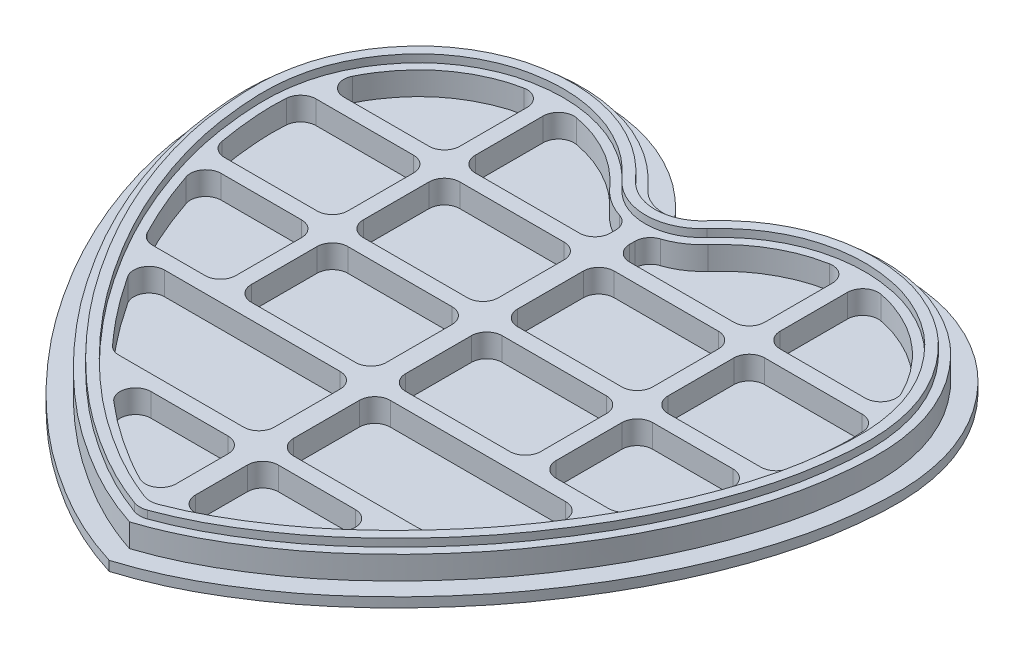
SolidWorks part; units mm, degrees
ref_plane "Front Plane" through (0, 0, 0) normal (0, 0, 1) x (1, 0, 0)
ref_plane "Top Plane" through (0, 0, 0) normal (0, 1, 0) x (1, 0, 0)
ref_plane "Right Plane" through (0, 0, 0) normal (1, 0, 0) x (0, 0, -1)
sketch "Sketch1" plane through (0, 0, 0) normal (0, 1, 0) x (1, 0, 0)
  arc A0 (-4.7475, 190.8725) -> (4.7475, 190.8725) centre (0, 195.0896) ccw
  spline S0 degree 3 poles (0, 0) (-6.9704, 2.1411) (-17.3052, 6.5092) (-30.2851, 14.3663) (-40.1508, 21.1835) (-49.6034, 29.0743) (-58.743, 37.7359) (-67.3785, 47.1382) (-75.5752, 57.1133) (-82.955, 67.7484) (-89.7919, 78.7217) (-95.738, 90.1158) (-100.8249, 101.7554) (-104.934, 113.6029) (-108.0334, 125.5149) (-109.7563, 137.4697) (-110.4471, 147.5565) (-110.0632, 155.7161) (-109.1075, 161.8984) (-107.688, 167.8632) (-105.6136, 173.5598) (-103.0387, 178.9712) (-99.994, 184.084) (-96.4904, 188.8114) (-92.6277, 193.2321) (-88.3533, 197.2568) (-83.6456, 200.8156) (-78.6368, 203.9332) (-73.2922, 206.5079) (-67.7257, 208.658) (-61.8582, 210.0699) (-55.8523, 211.0164) (-49.2375, 211.3688) (-42.1783, 210.9497) (-34.8451, 209.5327) (-27.8211, 207.308) (-21.2163, 204.1683) (-15.0288, 200.3457) (-9.5539, 195.8446) (-6.2412, 192.5542) (-4.7475, 190.8725) knots 0 0 0 0 0.062261 0.09531 0.129472 0.164592 0.200365 0.236953 0.273568 0.310548 0.347436 0.383933 0.420222 0.455837 0.490947 0.525167 0.558872 0.577133 0.594814 0.612233 0.62942 0.646491 0.663354 0.680162 0.696681 0.71344 0.73021 0.74701 0.763743 0.780818 0.797872 0.815181 0.832691 0.854352 0.875406 0.896334 0.917108 0.937714 0.958297 0.977512 0.977512 0.977512 0.977512
  spline S1 degree 3 poles (0, 0) (6.9704, 2.1411) (17.3052, 6.5092) (30.2851, 14.3663) (40.1508, 21.1835) (49.6034, 29.0743) (58.743, 37.7359) (67.3785, 47.1382) (75.5752, 57.1133) (82.955, 67.7484) (89.7919, 78.7217) (95.738, 90.1158) (100.8249, 101.7554) (104.934, 113.6029) (108.0334, 125.5149) (109.7563, 137.4697) (110.4471, 147.5565) (110.0632, 155.7161) (109.1075, 161.8984) (107.688, 167.8632) (105.6136, 173.5598) (103.0387, 178.9712) (99.994, 184.084) (96.4904, 188.8114) (92.6277, 193.2321) (88.3533, 197.2568) (83.6456, 200.8156) (78.6368, 203.9332) (73.2922, 206.5079) (67.7257, 208.658) (61.8582, 210.0699) (55.8523, 211.0164) (49.2375, 211.3688) (42.1783, 210.9497) (34.8451, 209.5327) (27.8211, 207.308) (21.2163, 204.1683) (15.0288, 200.3457) (9.5539, 195.8446) (6.2412, 192.5542) (4.7475, 190.8725) knots 0 0 0 0 0.062261 0.09531 0.129472 0.164592 0.200365 0.236953 0.273568 0.310548 0.347436 0.383933 0.420222 0.455837 0.490947 0.525167 0.558872 0.577133 0.594814 0.612233 0.62942 0.646491 0.663354 0.680162 0.696681 0.71344 0.73021 0.74701 0.763743 0.780818 0.797872 0.815181 0.832691 0.854352 0.875406 0.896334 0.917108 0.937714 0.958297 0.977512 0.977512 0.977512 0.977512
  dimension "D1" = 6.35
extrude "Boss-Extrude1" add sketch "Sketch1" along normal blind 3.175
sketch "Sketch4" plane through (0, 3.175, 0) normal (0, 1, 0) x (1, 0, 0)
  arc A1 (-9.495, 186.6555) -> (9.495, 186.6555) centre (0, 195.0896) ccw
  arc A2 (-9.495, 186.6555) -> (9.495, 186.6555) centre (0, 195.0896) ccw
  spline S4 degree 3 number of poles 122 (-9.495, 186.6555) -> (0, 6.6626)
  spline S5 degree 3 number of poles 124 (0, 6.6626) -> (9.495, 186.6555)
  spline S6 degree 3 number of poles 122 (-9.495, 186.6555) -> (0, 6.6626)
  spline S7 degree 3 number of poles 124 (0, 6.6626) -> (9.495, 186.6555)
  dimension "D1" = 6.35
extrude "Boss-Extrude3" add sketch "Sketch4" along normal blind 7.62
sketch "Sketch5" plane through (0, 10.795, 0) normal (0, 1, 0) x (1, 0, 0)
  line L1 (-3.175, 162.9059) -> (-3.175, 173.7344)
  line L2 (3.175, 162.9059) -> (3.175, 173.7344)
  line L3 (-93.1372, 162.9059) -> (-52.6696, 162.9059)
  line L4 (52.6696, 162.9059) -> (93.137, 162.9059)
  line L5 (-94.2805, 157.8259) -> (-52.6696, 157.8259)
  line L6 (3.175, 162.9059) -> (47.5896, 162.9059)
  line L7 (-92.3343, 126.0759) -> (-52.6696, 126.0759)
  line L8 (-47.5896, 162.9059) -> (-3.175, 162.9059)
  line L9 (-141.8606, 126.0759) -> (144.7018, 126.0759)
  line L10 (-141.8606, 157.8259) -> (144.7018, 157.8259)
  line L13 (-141.8606, 89.2459) -> (144.7018, 89.2459)
  line L14 (-141.8606, 120.9959) -> (144.7018, 120.9959)
  line L17 (-141.8606, 52.4159) -> (144.7018, 52.4159)
  line L18 (-141.8606, 84.1659) -> (144.7018, 84.1659)
  line L21 (-141.8606, 15.5859) -> (144.7018, 15.5859)
  line L22 (-141.8606, 47.3359) -> (144.7018, 47.3359)
  line L24 (-3.175, 17.2878) -> (-3.175, 47.3359)
  line L25 (-78.0235, 89.2459) -> (-52.6696, 89.2459)
  line L26 (-91.0427, 120.9959) -> (-52.6696, 120.9959)
  line L27 (3.175, 157.8259) -> (47.5896, 157.8259)
  line L28 (3.175, 17.2878) -> (3.175, 47.3359)
  line L29 (-51.4861, 52.4159) -> (-3.175, 52.4159)
  line L30 (-75.137, 84.1659) -> (-3.175, 84.1659)
  line L31 (-52.6696, 236.659) -> (-47.5896, 236.659)
  line L32 (3.175, 84.1659) -> (75.137, 84.1659)
  line L33 (3.175, 126.0759) -> (3.175, 157.8259)
  line L34 (-46.5896, 47.3359) -> (-3.175, 47.3359)
  line L35 (-3.175, 89.2459) -> (-3.175, 120.9959)
  line L37 (-8.843, 15.5859) -> (8.8433, 15.5859)
  line L38 (-52.6696, 195.8923) -> (-52.6696, 162.9059)
  line L39 (-3.175, 126.0759) -> (-3.175, 157.8259)
  line L40 (3.175, 126.0759) -> (47.5896, 126.0759)
  line L41 (3.175, 120.9959) -> (47.5896, 120.9959)
  line L42 (3.175, 89.2459) -> (47.5896, 89.2459)
  line L43 (3.175, 89.2459) -> (3.175, 120.9959)
  line L44 (3.175, 52.4159) -> (51.4862, 52.4159)
  line L45 (3.175, 47.3359) -> (46.5896, 47.3359)
  line L46 (-3.175, 52.4159) -> (-3.175, 84.1659)
  line L47 (3.175, 52.4159) -> (3.175, 84.1659)
  line L48 (52.6696, 157.8259) -> (94.2806, 157.8259)
  line L49 (-47.5896, 195.9577) -> (-47.5896, 162.9059)
  line L50 (-47.5896, 126.0759) -> (-3.175, 126.0759)
  line L52 (-52.6696, 120.9959) -> (-52.6696, 89.2459)
  line L53 (-47.5896, 120.9959) -> (-47.5896, 89.2459)
  line L54 (52.6696, 126.0759) -> (92.3343, 126.0759)
  line L55 (-47.5896, 157.8259) -> (-3.175, 157.8259)
  line L56 (-47.5896, 157.8259) -> (-47.5896, 126.0759)
  line L57 (-52.6696, 157.8259) -> (-52.6696, 126.0759)
  line L58 (-47.5896, 120.9959) -> (-3.175, 120.9959)
  line L59 (-47.5896, 89.2459) -> (-3.175, 89.2459)
  line L60 (47.5896, 195.9577) -> (47.5896, 126.0759)
  line L62 (52.6696, 195.8924) -> (52.6696, 126.0759)
  line L63 (52.6696, 120.9959) -> (91.0427, 120.9959)
  line L66 (47.5896, 120.9959) -> (47.5896, 89.2459)
  line L67 (52.6696, 120.9959) -> (52.6696, 89.2459)
  line L68 (52.6696, 89.2459) -> (78.0235, 89.2459)
  arc A1 (3.175, 173.7344) -> (16.1414, 180.7515) centre (0, 195.0896) ccw
  arc A6 (-16.1414, 180.7515) -> (16.1414, 180.7515) centre (0, 195.0896) ccw
  arc A7 (-16.1414, 180.7515) -> (-3.175, 173.7344) centre (0, 195.0896) ccw
  spline S0 degree 3 poles (47.5896, 195.9577) (47.4876, 195.9532) (47.3856, 195.9484) (46.5397, 195.9059) (45.7926, 195.8493) (44.3115, 195.6978) (43.5761, 195.6024) (41.3849, 195.2613) (39.9436, 194.961) (37.0959, 194.2297) (35.6892, 193.7996) (33.611, 193.0359) (32.9238, 192.7608) (31.5601, 192.1702) (30.8819, 191.8543) (28.8739, 190.8589) (27.5742, 190.1394) (25.6855, 188.973) (25.0664, 188.5692) (23.8519, 187.7276) (23.2569, 187.2892) (21.5048, 185.9269) (20.3789, 184.9583) (18.1913, 182.929) (17.1344, 181.8693) (16.1414, 180.7515) knots 0.873928 0.873928 0.873928 0.873928 0.875 0.875 0.882812 0.882812 0.890625 0.890625 0.90625 0.90625 0.921875 0.921875 0.929687 0.929687 0.9375 0.9375 0.953125 0.953125 0.960937 0.960937 0.96875 0.96875 0.984375 0.984375 1 1 1 1
  spline S1 degree 3 poles (93.137, 162.9059) (93.0147, 163.3366) (92.8856, 163.7639) (92.5235, 164.8889) (92.2788, 165.5808) (91.4957, 167.6324) (90.9106, 168.9692) (89.625, 171.5861) (88.9248, 172.8663) (87.3985, 175.3649) (86.5683, 176.5813) (85.2315, 178.3609) (84.7735, 178.9447) (83.8387, 180.0894) (83.3609, 180.6508) (81.8939, 182.3001) (80.8705, 183.3521) (78.7152, 185.3425) (77.581, 186.2786) (75.2083, 188.0416) (73.9688, 188.8772) (72.0724, 190.0241) (71.4324, 190.3887) (70.136, 191.0801) (69.4798, 191.4079) (68.1545, 192.0339) (67.4855, 192.3325) (66.1364, 192.9045) (65.4559, 193.1771) (64.0783, 193.6844) (63.3808, 193.9181) (61.9637, 194.3357) (61.2448, 194.5212) (59.7924, 194.8586) (59.0626, 195.0102) (57.6029, 195.2858) (56.8719, 195.4095) (54.9864, 195.6854) (53.8298, 195.8117) (52.6696, 195.8924) knots 0.659341 0.659341 0.659341 0.659341 0.664062 0.664062 0.671875 0.671875 0.6875 0.6875 0.703125 0.703125 0.71875 0.71875 0.726562 0.726562 0.734375 0.734375 0.75 0.75 0.765625 0.765625 0.78125 0.78125 0.789062 0.789062 0.796875 0.796875 0.804687 0.804687 0.8125 0.8125 0.820312 0.820312 0.828125 0.828125 0.835937 0.835937 0.84375 0.84375 0.856053 0.856053 0.856053 0.856053
  spline S3 degree 3 poles (51.4862, 52.4159) (53.037, 54.0896) (54.558, 55.792) (57.9625, 59.7266) (59.8302, 61.9741) (62.5419, 65.4315) (63.4303, 66.5987) (65.1754, 68.9638) (66.0325, 70.1611) (67.721, 72.5803) (68.5519, 73.8016) (70.1859, 76.2535) (70.9904, 77.4853) (72.9319, 80.5225) (74.0526, 82.3356) (75.137, 84.1659) knots 0.225541 0.225541 0.225541 0.225541 0.25 0.25 0.28125 0.28125 0.296875 0.296875 0.3125 0.3125 0.328125 0.328125 0.34375 0.34375 0.366455 0.366455 0.366455 0.366455
  spline S4 degree 3 poles (-75.137, 84.1659) (-74.0404, 82.3151) (-72.9069, 80.4821) (-70.9511, 77.4248) (-70.1456, 76.1924) (-68.5099, 73.7394) (-67.6786, 72.5185) (-65.1479, 68.8962) (-63.4066, 66.5321) (-59.7922, 61.9275) (-57.9247, 59.6816) (-54.5325, 55.7636) (-53.0242, 54.0758) (-51.4861, 52.4159) knots 0.633313 0.633313 0.633313 0.633313 0.65625 0.65625 0.671875 0.671875 0.6875 0.6875 0.71875 0.71875 0.75 0.75 0.774254 0.774254 0.774254 0.774254
  spline S5 degree 3 poles (-46.5896, 47.3359) (-45.7271, 46.4767) (-44.8553, 45.6263) (-41.8618, 42.7686) (-39.6973, 40.8013) (-35.2601, 36.9682) (-32.9822, 35.1054) (-28.271, 31.5334) (-25.8603, 29.845) (-22.1874, 27.4132) (-20.9542, 26.6183) (-18.4681, 25.0637) (-17.2146, 24.3048) (-14.6812, 22.8339) (-13.4011, 22.1222) (-10.8085, 20.7561) (-9.4965, 20.101) (-6.5289, 18.7013) (-4.8648, 17.9717) (-3.175, 17.2878) knots 0.79946 0.79946 0.79946 0.79946 0.8125 0.8125 0.84375 0.84375 0.875 0.875 0.90625 0.90625 0.921875 0.921875 0.9375 0.9375 0.953125 0.953125 0.96875 0.96875 0.988036 0.988036 0.988036 0.988036
  spline S6 degree 3 poles (78.0235, 89.2459) (78.8709, 90.8037) (79.6912, 92.3744) (81.7938, 96.5641) (83.0343, 99.203) (86.5406, 107.2219) (88.5802, 112.7093) (90.542, 119.2338) (90.797, 120.1127) (91.0427, 120.9959) knots 0.387272 0.387272 0.387272 0.387272 0.40625 0.40625 0.4375 0.4375 0.5 0.5 0.50968 0.50968 0.50968 0.50968
  spline S7 degree 3 poles (-91.0427, 120.9959) (-90.7976, 120.1152) (-90.5427, 119.2363) (-88.5765, 112.6964) (-86.5312, 107.1972) (-83.0167, 99.1644) (-81.7735, 96.5216) (-79.6752, 92.3438) (-78.8626, 90.7885) (-78.0235, 89.2459) knots 0.490345 0.490345 0.490345 0.490345 0.5 0.5 0.5625 0.5625 0.59375 0.59375 0.612518 0.612518 0.612518 0.612518
  spline S8 degree 3 poles (92.3343, 126.0759) (92.4008, 126.3663) (92.466, 126.657) (93.1646, 129.8372) (93.6589, 132.7486) (94.2407, 137.1407) (94.4096, 138.6086) (94.7006, 141.5518) (94.8216, 143.0281) (94.991, 145.9887) (95.0388, 147.4658) (95.0349, 150.4117) (94.9831, 151.8805) (94.7439, 154.8065) (94.5519, 156.2634) (94.2935, 157.752) (94.287, 157.789) (94.2806, 157.8259) knots 0.528104 0.528104 0.528104 0.528104 0.53125 0.53125 0.5625 0.5625 0.578125 0.578125 0.59375 0.59375 0.609375 0.609375 0.625 0.625 0.640625 0.640625 0.641022 0.641022 0.641022 0.641022
  spline S10 degree 3 poles (-52.6696, 195.8923) (-53.8064, 195.8133) (-54.9414, 195.6903) (-56.8083, 195.4198) (-57.5414, 195.2966) (-59.0063, 195.0216) (-59.7378, 194.8703) (-61.1847, 194.5362) (-61.9015, 194.3524) (-63.3165, 193.9386) (-64.014, 193.7066) (-65.3926, 193.2017) (-66.0742, 192.9299) (-67.4262, 192.3585) (-68.097, 192.06) (-69.427, 191.4337) (-70.086, 191.1057) (-71.3894, 190.4127) (-72.0333, 190.0469) (-73.3065, 189.2786) (-73.9361, 188.8767) (-75.1684, 188.0488) (-75.7728, 187.6215) (-77.5521, 186.3014) (-78.6889, 185.3654) (-80.8533, 183.3694) (-81.8833, 182.3123) (-83.361, 180.6504) (-83.8431, 180.0832) (-84.7851, 178.9297) (-85.2435, 178.3455) (-86.5772, 176.5683) (-87.4089, 175.3495) (-88.9428, 172.8352) (-89.649, 171.5421) (-90.623, 169.5519) (-90.9332, 168.8799) (-91.5239, 167.5184) (-91.8054, 166.8271) (-92.3314, 165.4354) (-92.5756, 164.7358) (-92.9177, 163.6578) (-93.0302, 163.2824) (-93.1372, 162.9059) knots 0.144186 0.144186 0.144186 0.144186 0.15625 0.15625 0.164062 0.164062 0.171875 0.171875 0.179687 0.179687 0.1875 0.1875 0.195312 0.195312 0.203125 0.203125 0.210937 0.210937 0.21875 0.21875 0.226562 0.226562 0.234375 0.234375 0.25 0.25 0.265625 0.265625 0.273437 0.273437 0.28125 0.28125 0.296875 0.296875 0.3125 0.3125 0.320313 0.320313 0.328125 0.328125 0.335938 0.335938 0.340092 0.340092 0.340092 0.340092
  spline S14 degree 3 poles (-94.2805, 157.8259) (-94.2937, 157.751) (-94.3067, 157.6762) (-94.5676, 156.1545) (-94.7574, 154.6961) (-94.9901, 151.7501) (-95.0386, 150.2585) (-95.0361, 147.2985) (-94.9847, 145.8255) (-94.8111, 142.8893) (-94.6894, 141.4261) (-94.3982, 138.5064) (-94.2296, 137.0498) (-93.6492, 132.6902) (-93.1568, 129.7987) (-92.4628, 126.6428) (-92.3992, 126.3592) (-92.3343, 126.0759) knots 0.358566 0.358566 0.358566 0.358566 0.359375 0.359375 0.375 0.375 0.390625 0.390625 0.40625 0.40625 0.421875 0.421875 0.4375 0.4375 0.46875 0.46875 0.471837 0.471837 0.471837 0.471837
  spline S18 degree 3 poles (3.175, 17.2878) (4.8687, 17.9733) (6.5369, 18.7048) (9.5115, 20.1083) (10.8263, 20.7652) (13.4247, 22.1351) (14.7079, 22.849) (17.2479, 24.3246) (18.5048, 25.0862) (20.9981, 26.6463) (22.2351, 27.444) (24.6911, 29.0717) (25.9097, 29.9027) (28.3238, 31.6062) (29.5211, 32.4798) (33.047, 35.1567) (35.3181, 37.0174) (39.7484, 40.8461) (41.9093, 42.8125) (44.8849, 45.6552) (45.7418, 46.4912) (46.5896, 47.3359) knots 0.011949 0.011949 0.011949 0.011949 0.03125 0.03125 0.046875 0.046875 0.0625 0.0625 0.078125 0.078125 0.09375 0.09375 0.109375 0.109375 0.125 0.125 0.15625 0.15625 0.1875 0.1875 0.200327 0.200327 0.200327 0.200327
  spline S19 degree 3 poles (-16.1414, 180.7515) (-17.1349, 181.8699) (-18.1822, 182.9194) (-20.3465, 184.9293) (-21.4624, 185.8912) (-23.203, 187.2486) (-23.7947, 187.6863) (-25.0047, 188.5279) (-25.6224, 188.9325) (-26.8807, 189.7122) (-27.5213, 190.0875) (-28.8233, 190.8114) (-29.4864, 191.1613) (-31.4896, 192.158) (-32.8468, 192.7518) (-35.6124, 193.7744) (-37.0192, 194.2076) (-39.8727, 194.9452) (-41.3195, 195.249) (-43.5234, 195.5954) (-44.2662, 195.6923) (-45.7498, 195.8456) (-46.4908, 195.9025) (-47.3505, 195.9468) (-47.4701, 195.9525) (-47.5896, 195.9577) knots 0 0 0 0 0.015625 0.015625 0.03125 0.03125 0.039063 0.039063 0.046875 0.046875 0.054688 0.054688 0.0625 0.0625 0.078125 0.078125 0.09375 0.09375 0.109375 0.109375 0.117187 0.117187 0.125 0.125 0.126262 0.126262 0.126262 0.126262
  point P2 (-50.1296, 162.9059)
  point P7 (0, 102.3991)
  point P9 (50.1296, 162.9059)
  dimension "D2" = 5.08
  dimension "D3" = 31.75
  dimension "D6" = 6.35
  dimension "D1" = 5.08
  dimension "D7" = 5.08
  dimension "D9" = 8.89
  dimension "D4" = 2
  dimension "D5" = 4
extrude "Cut-Extrude1" cut sketch "Sketch5" against normal up to surface (7.62 mm away)
fillet "Fillet1" radius 5.08 60 edges at (-52.6696, 6.985, -89.2459) (-52.6696, 6.985, -120.9959) (-52.6696, 6.985, -157.8259) (-52.6696, 6.985, -126.0759) (-3.175, 6.985, -157.8259) (-47.5896, 6.985, -157.8259) (-3.175, 6.985, -126.0759) (-47.5896, 6.985, -126.0759) (-3.175, 6.985, -120.9959) (-47.5896, 6.985, -120.9959) (-47.5896, 6.985, -89.2459) (-3.175, 6.985, -89.2459) (3.175, 6.985, -47.3359) (-3.175, 6.985, -47.3359) (-3.175, 6.985, -84.1659) (-3.175, 6.985, -52.4159) (3.175, 6.985, -84.1659) (3.175, 6.985, -52.4159) (52.6696, 6.985, -120.9959) (52.6696, 6.985, -89.2459) (47.5896, 6.985, -120.9959) (47.5896, 6.985, -89.2459) (3.175, 6.985, -89.2459) (3.175, 6.985, -120.9959) (47.5896, 6.985, -126.0759) (3.175, 6.985, -126.0759) (3.175, 6.985, -157.8259) (47.5896, 6.985, -157.8259) (52.6696, 6.985, -126.0759) (52.6696, 6.985, -157.8259) (52.6696, 6.985, -162.9059) (47.5896, 6.985, -162.9059) (3.175, 6.985, -162.9059) (-3.175, 6.985, -162.9059) (-52.6696, 6.985, -162.9059) (-47.5896, 6.985, -162.9059) (-3.175, 6.985, -173.7344) (3.175, 6.985, -173.7344)
sketch "Sketch7" plane through (0, 10.795, 0) normal (0, 1, 0) x (1, 0, 0)
  arc A1 (-11.6313, 184.7578) -> (11.6313, 184.7578) centre (0, 195.0896) ccw
  arc A2 (-12.8182, 183.7035) -> (12.8182, 183.7035) centre (0, 195.0896) ccw
  arc A3 (-12.8182, 183.7035) -> (12.8182, 183.7035) centre (0, 195.0896) ccw construction
  arc A4 (-14.0051, 182.6492) -> (14.0051, 182.6492) centre (0, 195.0896) ccw
  spline S2 degree 1 poles (-11.6313, 184.7578) (0, 9.6734) knots 0 0 1 1 construction
  spline S3 degree 1 poles (0, 9.6734) (11.6313, 184.7578) knots 0 0 1 1 construction
  spline S4 degree 3 number of poles 118 (0, 11.3528) -> (12.8182, 183.7035)
  spline S5 degree 3 number of poles 122 (-12.8182, 183.7035) -> (0, 11.3528)
  spline S6 degree 3 number of poles 118 (0, 11.3528) -> (12.8182, 183.7035) construction
  spline S7 degree 3 number of poles 122 (-12.8182, 183.7035) -> (0, 11.3528) construction
  spline S8 degree 3 poles (-11.6313, 184.7578) (-12.1762, 185.3711) (-13.3049, 186.5737) (-15.6301, 188.8243) (-18.6675, 191.4628) (-22.6531, 194.2833) (-26.9068, 196.6923) (-31.4022, 198.7407) (-36.0291, 200.2484) (-40.7533, 201.3353) (-45.6675, 201.968) (-50.5488, 202.0989) (-55.4155, 201.773) (-60.2197, 200.9875) (-65.0217, 199.8329) (-69.5492, 198.0716) (-73.9001, 196.0066) (-78.105, 193.4305) (-83.3243, 189.5567) (-87.861, 184.8887) (-91.8069, 179.7104) (-94.375, 175.5857) (-96.5447, 171.2654) (-98.3702, 166.6968) (-99.6632, 161.9816) (-100.5479, 157.2767) (-101.0453, 152.4372) (-101.1283, 145.9443) (-100.5052, 138.0547) (-99.1902, 128.6681) (-96.9758, 119.3883) (-94.0929, 110.2663) (-89.5387, 98.4964) (-84.0271, 87.2153) (-77.546, 76.4216) (-72.3374, 68.5284) (-66.7298, 60.8362) (-60.7212, 53.5987) (-54.4423, 46.6298) (-47.7984, 39.9869) (-40.8266, 33.692) (-33.4332, 27.73) (-25.5542, 22.3211) (-17.4876, 17.3489) (-10.3999, 13.7649) (-4.5271, 11.2883) (-1.5126, 10.1955) (0, 9.6734) knots 0 0 0 0 0.007827 0.015653 0.031306 0.04696 0.062613 0.078266 0.093919 0.109573 0.125226 0.140879 0.156532 0.172186 0.187839 0.203492 0.219145 0.234798 0.250452 0.281758 0.297411 0.313065 0.328718 0.344371 0.360024 0.375678 0.391331 0.406984 0.43829 0.469597 0.500903 0.53221 0.563516 0.626129 0.657436 0.688742 0.720049 0.751355 0.782662 0.813968 0.845274 0.876581 0.907887 0.939194 0.9705 0.986154 1.001807 1.001807 1.001807 1.001807
  spline S9 degree 3 poles (0, 9.6734) (1.5144, 10.1961) (4.5323, 11.2901) (10.4121, 13.7712) (17.508, 17.3598) (25.5848, 22.3409) (33.4734, 27.759) (40.869, 33.7297) (50.1822, 42.1355) (58.7882, 51.2551) (66.8032, 60.9308) (72.4194, 68.6467) (77.6191, 76.5391) (82.4787, 84.636) (86.829, 92.9889) (90.7328, 101.5587) (94.1335, 110.3875) (97.0103, 119.505) (99.2245, 128.8478) (100.5354, 138.2962) (101.1404, 146.2872) (101.0295, 152.6998) (100.5102, 157.5211) (99.6005, 162.2725) (98.2587, 167.016) (96.4412, 171.4881) (94.2612, 175.7921) (91.6386, 179.9528) (88.6895, 183.779) (85.4651, 187.3667) (81.847, 190.6654) (77.8966, 193.5689) (73.7476, 196.0869) (70.1026, 197.8042) (67.1107, 199.0191) (64.7571, 199.8287) (62.3814, 200.469) (59.237, 201.1502) (55.2718, 201.7892) (50.418, 202.102) (45.5085, 201.9541) (40.6963, 201.3227) (35.9985, 200.2408) (31.334, 198.7146) (26.8836, 196.6773) (22.6978, 194.31) (18.7029, 191.4919) (15.0207, 188.2984) (12.7144, 185.9771) (11.6313, 184.7578) knots -0.001805 -0.001805 -0.001805 -0.001805 0.013848 0.029502 0.060808 0.092114 0.123421 0.154727 0.186034 0.248646 0.279953 0.311259 0.342566 0.373872 0.405178 0.436485 0.467791 0.499098 0.530404 0.56171 0.593017 0.60867 0.624323 0.639976 0.65563 0.671283 0.686936 0.702589 0.718242 0.733896 0.749549 0.765202 0.780855 0.796508 0.804335 0.812162 0.819988 0.827815 0.843468 0.859121 0.874774 0.890428 0.906081 0.921734 0.937387 0.95304 0.968694 0.984347 1 1 1 1
  spline S10 degree 1 poles (-14.0051, 182.6492) (0, 13.0339) knots 0 0 1 1 construction
  spline S11 degree 1 poles (0, 13.0339) (14.0051, 182.6492) knots 0 0 1 1 construction
  spline S12 degree 3 poles (-14.0051, 182.6492) (-15.0184, 183.79) (-17.1743, 185.9598) (-20.6268, 188.9561) (-24.295, 191.5583) (-28.3055, 193.8361) (-32.4771, 195.7444) (-36.7748, 197.1556) (-41.2104, 198.1854) (-45.7702, 198.7857) (-50.3421, 198.9214) (-54.8737, 198.6348) (-58.6559, 198.0285) (-61.6731, 197.3721) (-63.8514, 196.7823) (-65.966, 196.0559) (-68.7704, 194.9189) (-72.1923, 193.3127) (-76.1072, 190.9427) (-79.794, 188.2325) (-83.1308, 185.2038) (-86.1961, 181.8084) (-89.0173, 178.1511) (-91.434, 174.3271) (-93.5014, 170.2787) (-95.2385, 166.0144) (-96.4747, 161.6733) (-97.344, 157.1855) (-97.8459, 152.6928) (-97.9703, 146.5301) (-97.3981, 138.8731) (-96.1521, 129.7386) (-94.0654, 120.7816) (-91.2823, 111.8585) (-86.8864, 100.3599) (-81.5334, 89.3) (-75.2483, 78.7288) (-70.1387, 70.9429) (-64.7048, 63.4073) (-58.8499, 56.2912) (-52.7068, 49.4224) (-46.2492, 42.897) (-39.4371, 36.6932) (-32.3008, 30.8526) (-24.6506, 25.5245) (-16.7875, 20.6147) (-8.6423, 16.3843) (-2.9068, 14.0556) (0, 13.0339) knots 0 0 0 0 0.015596 0.031193 0.046789 0.062385 0.077981 0.093578 0.109174 0.12477 0.140366 0.155963 0.171559 0.179357 0.187155 0.194953 0.202751 0.218348 0.233944 0.24954 0.265136 0.280733 0.296329 0.311925 0.327522 0.343118 0.358714 0.37431 0.389907 0.405503 0.436695 0.467888 0.49908 0.530273 0.561465 0.623851 0.655043 0.686236 0.717428 0.748621 0.779813 0.811006 0.842198 0.873391 0.904583 0.935776 0.966968 0.998161 0.998161 0.998161 0.998161
  spline S13 degree 3 poles (0, 13.0339) (2.9102, 14.0568) (8.6515, 16.3894) (16.8075, 20.6257) (24.681, 25.5443) (32.3393, 30.881) (39.4802, 36.7305) (46.2995, 42.9447) (52.7641, 49.4834) (58.9157, 56.3672) (64.7779, 63.501) (70.218, 71.0588) (75.3195, 78.8438) (80.0324, 86.7747) (84.251, 94.9541) (88.0398, 103.353) (91.3207, 111.975) (94.0995, 120.8985) (96.1845, 129.9139) (97.4279, 139.1164) (97.9798, 146.8608) (97.829, 152.9324) (97.3071, 157.418) (96.4111, 161.9551) (95.1346, 166.3033) (93.4034, 170.4854) (90.6341, 175.8706) (87.0699, 180.8661) (83.0012, 185.3326) (79.6327, 188.3653) (75.9112, 191.071) (72.0517, 193.3847) (67.9216, 195.3145) (63.6635, 196.9196) (59.2345, 197.9376) (54.7413, 198.6497) (50.2171, 198.9238) (44.097, 198.7221) (38.1948, 197.6247) (32.4124, 195.7196) (28.2856, 193.823) (24.3367, 191.583) (20.6618, 188.9858) (17.1645, 185.9514) (15.0184, 183.79) (14.0051, 182.6492) knots 0.001837 0.001837 0.001837 0.001837 0.03303 0.064222 0.095415 0.126607 0.1578 0.188993 0.220185 0.251378 0.28257 0.313763 0.344956 0.376148 0.407341 0.438533 0.469726 0.500919 0.532111 0.563304 0.594496 0.610093 0.625689 0.641285 0.656881 0.672478 0.688074 0.719267 0.734863 0.750459 0.766056 0.781652 0.797248 0.812844 0.828441 0.844037 0.859633 0.87523 0.906422 0.922019 0.937615 0.953211 0.968807 0.984404 1 1 1 1
  dimension "D1" = 4.445
  dimension "D2" = 1.5875
  dimension "D3" = 1.5875
extrude "Boss-Extrude4" add sketch "Sketch7" along normal blind 2.54
fillet "Fillet2" radius 6.35 2 edges at (0, 12.065, -9.6734) (0, 12.065, -13.0339)
sketch "Sketch9" plane through (0, 0, 0) normal (0, -1, 0) x (1, 0, 0)
  line L0 (0, 0) -> (0, -188.7396) construction
  line L1 (108.921, -131.9913) -> (-108.921, -131.9913) construction
  arc A0 (4.7475, -190.8725) -> (-4.7475, -190.8725) centre (0, -195.0896) ccw construction
  spline S0 degree 3 poles (0, 0) (6.9704, -2.1411) (17.3052, -6.5092) (30.2851, -14.3663) (40.1508, -21.1835) (49.6034, -29.0743) (58.743, -37.7359) (67.3785, -47.1382) (75.5752, -57.1133) (82.955, -67.7484) (89.7919, -78.7217) (95.738, -90.1158) (100.8249, -101.7554) (104.934, -113.6029) (108.0334, -125.5149) (109.7563, -137.4697) (110.4471, -147.5565) (110.0632, -155.7161) (109.1075, -161.8984) (107.688, -167.8632) (105.6136, -173.5598) (103.0387, -178.9712) (99.994, -184.084) (96.4904, -188.8114) (92.6277, -193.2321) (88.3533, -197.2568) (83.6456, -200.8156) (78.6368, -203.9332) (73.2922, -206.5079) (67.7257, -208.658) (61.8582, -210.0699) (55.8523, -211.0164) (49.2375, -211.3688) (42.1783, -210.9497) (34.8451, -209.5327) (27.8211, -207.308) (21.2163, -204.1683) (15.0288, -200.3457) (9.5539, -195.8446) (6.2412, -192.5542) (4.7475, -190.8725) knots 0 0 0 0 0.062261 0.09531 0.129472 0.164592 0.200365 0.236953 0.273568 0.310548 0.347436 0.383933 0.420222 0.455837 0.490947 0.525167 0.558872 0.577133 0.594814 0.612233 0.62942 0.646491 0.663354 0.680162 0.696681 0.71344 0.73021 0.74701 0.763743 0.780818 0.797872 0.815181 0.832691 0.854352 0.875406 0.896334 0.917108 0.937714 0.958297 0.977512 0.977512 0.977512 0.977512 construction
  spline S1 degree 3 poles (0, 0) (-6.9704, -2.1411) (-17.3052, -6.5092) (-30.2851, -14.3663) (-40.1508, -21.1835) (-49.6034, -29.0743) (-58.743, -37.7359) (-67.3785, -47.1382) (-75.5752, -57.1133) (-82.955, -67.7484) (-89.7919, -78.7217) (-95.738, -90.1158) (-100.8249, -101.7554) (-104.934, -113.6029) (-108.0334, -125.5149) (-109.7563, -137.4697) (-110.4471, -147.5565) (-110.0632, -155.7161) (-109.1075, -161.8984) (-107.688, -167.8632) (-105.6136, -173.5598) (-103.0387, -178.9712) (-99.994, -184.084) (-96.4904, -188.8114) (-92.6277, -193.2321) (-88.3533, -197.2568) (-83.6456, -200.8156) (-78.6368, -203.9332) (-73.2922, -206.5079) (-67.7257, -208.658) (-61.8582, -210.0699) (-55.8523, -211.0164) (-49.2375, -211.3688) (-42.1783, -210.9497) (-34.8451, -209.5327) (-27.8211, -207.308) (-21.2163, -204.1683) (-15.0288, -200.3457) (-9.5539, -195.8446) (-6.2412, -192.5542) (-4.7475, -190.8725) knots 0 0 0 0 0.062261 0.09531 0.129472 0.164592 0.200365 0.236953 0.273568 0.310548 0.347436 0.383933 0.420222 0.455837 0.490947 0.525167 0.558872 0.577133 0.594814 0.612233 0.62942 0.646491 0.663354 0.680162 0.696681 0.71344 0.73021 0.74701 0.763743 0.780818 0.797872 0.815181 0.832691 0.854352 0.875406 0.896334 0.917108 0.937714 0.958297 0.977512 0.977512 0.977512 0.977512 construction
  text T0 "Wood you be  My Valentine?" font "Times New Roman" height in points 75
extrude "Cut-Extrude3" cut sketch "Sketch9" against normal blind 1.27
